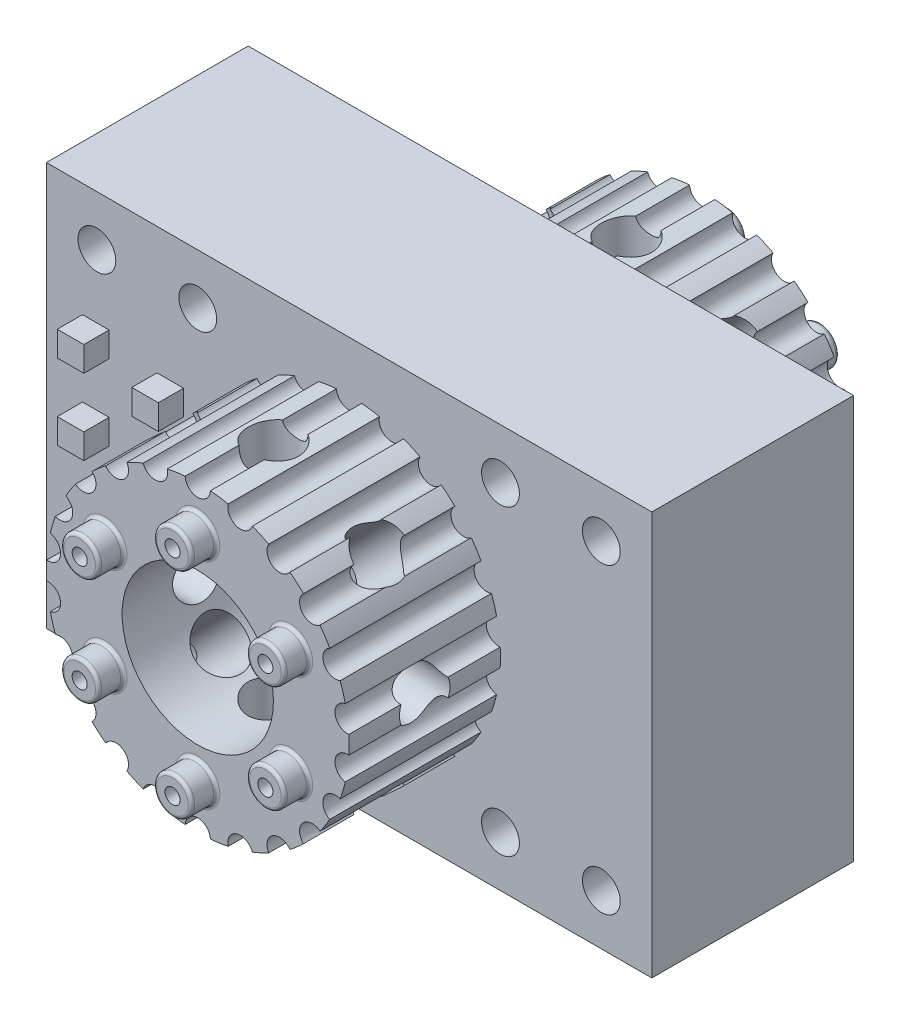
SolidWorks part; units mm, degrees
ref_plane "Front Plane" through (0, 0, 0) normal (0, 0, 1) x (1, 0, 0)
ref_plane "Top Plane" through (0, 0, 0) normal (0, 1, 0) x (1, 0, 0)
ref_plane "Right Plane" through (0, 0, 0) normal (1, 0, 0) x (0, 0, -1)
sketch "Sketch1" plane through (0, 0, 0) normal (0, 0, 1) x (1, 0, 0)
  line L1 (-76.2, -50.8) -> (76.2, -50.8)
  line L2 (-76.2, -50.8) -> (-76.2, 50.8)
  line L3 (-76.2, 50.8) -> (76.2, 50.8)
  line L4 (76.2, -50.8) -> (76.2, 50.8)
  line L5 (-76.2, -50.8) -> (76.2, 50.8) construction
  line L6 (-76.2, 50.8) -> (76.2, -50.8) construction
  point P0 (0, 0)
  dimension "D1" = 101.6
  dimension "D2" = 152.4
extrude "Boss-Extrude1" add sketch "Sketch1" along normal blind 25.4
sketch "Sketch2" plane through (0, 0, 25.4) normal (0, 0, 1) x (1, 0, 0)
  circle A0 centre (0, 0) radius 38.1
  dimension "D1" = 76.2
extrude "Extrude-Thin1" add sketch "Sketch2" along normal blind 38.1 thin
sketch "Sketch3" plane through (0, 0, 25.4) normal (0, 0, 1) x (1, 0, 0)
  line L0 (-76.2, 50.8) -> (-76.2, -50.8) construction
  line L1 (76.2, 50.8) -> (-76.2, 50.8) construction
  line L2 (-63.5, 38.1) -> (-38.1, 38.1) construction
  line L3 (-63.5, 38.1) -> (-63.5, -38.1) construction
  circle A0 centre (-63.5, 38.1) radius 4.7625
  circle A1 centre (-38.1, 38.1) radius 4.7625
  circle A2 centre (-12.7, 38.1) radius 4.7625
  circle A3 centre (12.7, 38.1) radius 4.7625
  circle A4 centre (38.1, 38.1) radius 4.7625
  circle A5 centre (63.5, 38.1) radius 4.7625
  circle A6 centre (-38.1, -38.1) radius 4.7625
  circle A7 centre (-12.7, -38.1) radius 4.7625
  circle A8 centre (12.7, -38.1) radius 4.7625
  circle A9 centre (38.1, -38.1) radius 4.7625
  circle A10 centre (63.5, -38.1) radius 4.7625
  circle A11 centre (-63.5, -38.1) radius 4.7625
  point P6 (63.4803, 38.0737)
  point P7 (63.2484, 37.7654)
  point P8 (0, 0)
  point P34 (63.5, -38.8955)
  dimension "D1" = 9.525
  dimension "D2" = 12.7
  dimension "D3" = 12.7
  dimension "D6" = 90
  dimension "D7" = 25.4
  dimension "D8" = 76.2
  dimension "D4" = 6
  dimension "D5" = 2
extrude "Cut-Extrude1" cut sketch "Sketch3" against normal through all
sketch "Sketch4" plane through (0, 0, 63.5) normal (0, 0, 1) x (1, 0, 0)
  arc A0 (-3.1722, 37.9677) -> (3.1722, 37.9677) centre (0, 38.1) ccw
  circle A1 centre (0, 0) radius 38.1 construction
  arc A2 (3.1722, 37.9677) -> (-3.1722, 37.9677) centre (0, 0) ccw
  arc A3 (13.7405, 35.536) -> (7.653, 37.3235) centre (0, 0) ccw
  arc A4 (7.653, 37.3235) -> (13.7405, 35.536) centre (10.734, 36.5567) ccw
  arc A5 (23.1956, 30.2254) -> (17.8582, 33.6555) centre (0, 0) ccw
  arc A6 (17.8582, 33.6555) -> (23.1956, 30.2254) centre (20.5984, 32.0518) ccw
  arc A7 (30.7715, 22.4661) -> (26.6167, 27.261) centre (0, 0) ccw
  arc A8 (26.6167, 27.261) -> (30.7715, 22.4661) centre (28.7941, 24.9502) ccw
  arc A9 (35.8544, 12.8868) -> (33.2188, 18.6579) centre (0, 0) ccw
  arc A10 (33.2188, 18.6579) -> (35.8544, 12.8868) centre (34.657, 15.8273) ccw
  arc A11 (38.0327, 2.2634) -> (37.1298, 8.5433) centre (0, 0) ccw
  arc A12 (37.1298, 8.5433) -> (38.0327, 2.2634) centre (37.7122, 5.4222) ccw
  arc A13 (37.1298, -8.5433) -> (38.0327, -2.2634) centre (0, 0) ccw
  arc A14 (38.0327, -2.2634) -> (37.1298, -8.5433) centre (37.7122, -5.4222) ccw
  arc A15 (33.2188, -18.6579) -> (35.8544, -12.8868) centre (0, 0) ccw
  arc A16 (35.8544, -12.8868) -> (33.2188, -18.6579) centre (34.657, -15.8273) ccw
  arc A17 (26.6167, -27.261) -> (30.7715, -22.4661) centre (0, 0) ccw
  arc A18 (30.7715, -22.4661) -> (26.6167, -27.261) centre (28.7941, -24.9502) ccw
  arc A19 (17.8582, -33.6555) -> (23.1956, -30.2254) centre (0, 0) ccw
  arc A20 (23.1956, -30.2254) -> (17.8582, -33.6555) centre (20.5984, -32.0518) ccw
  arc A21 (7.653, -37.3235) -> (13.7405, -35.536) centre (0, 0) ccw
  arc A22 (13.7405, -35.536) -> (7.653, -37.3235) centre (10.734, -36.5567) ccw
  arc A23 (-3.1722, -37.9677) -> (3.1722, -37.9677) centre (0, 0) ccw
  arc A24 (3.1722, -37.9677) -> (-3.1722, -37.9677) centre (0, -38.1) ccw
  arc A25 (-13.7405, -35.536) -> (-7.653, -37.3235) centre (0, 0) ccw
  arc A26 (-7.653, -37.3235) -> (-13.7405, -35.536) centre (-10.734, -36.5567) ccw
  arc A27 (-23.1956, -30.2254) -> (-17.8582, -33.6555) centre (0, 0) ccw
  arc A28 (-17.8582, -33.6555) -> (-23.1956, -30.2254) centre (-20.5984, -32.0518) ccw
  arc A29 (-30.7715, -22.4661) -> (-26.6167, -27.261) centre (0, 0) ccw
  arc A30 (-26.6167, -27.261) -> (-30.7715, -22.4661) centre (-28.7941, -24.9502) ccw
  arc A31 (-35.8544, -12.8868) -> (-33.2188, -18.6579) centre (0, 0) ccw
  arc A32 (-33.2188, -18.6579) -> (-35.8544, -12.8868) centre (-34.657, -15.8273) ccw
  arc A33 (-38.0327, -2.2634) -> (-37.1298, -8.5433) centre (0, 0) ccw
  arc A34 (-37.1298, -8.5433) -> (-38.0327, -2.2634) centre (-37.7122, -5.4222) ccw
  arc A35 (-37.1298, 8.5433) -> (-38.0327, 2.2634) centre (0, 0) ccw
  arc A36 (-38.0327, 2.2634) -> (-37.1298, 8.5433) centre (-37.7122, 5.4222) ccw
  arc A37 (-33.2188, 18.6579) -> (-35.8544, 12.8868) centre (0, 0) ccw
  arc A38 (-35.8544, 12.8868) -> (-33.2188, 18.6579) centre (-34.657, 15.8273) ccw
  arc A39 (-26.6167, 27.261) -> (-30.7715, 22.4661) centre (0, 0) ccw
  arc A40 (-30.7715, 22.4661) -> (-26.6167, 27.261) centre (-28.7941, 24.9502) ccw
  arc A41 (-17.8582, 33.6555) -> (-23.1956, 30.2254) centre (0, 0) ccw
  arc A42 (-23.1956, 30.2254) -> (-17.8582, 33.6555) centre (-20.5984, 32.0518) ccw
  arc A43 (-7.653, 37.3235) -> (-13.7405, 35.536) centre (0, 0) ccw
  arc A44 (-13.7405, 35.536) -> (-7.653, 37.3235) centre (-10.734, 36.5567) ccw
  point P72 (0, 0)
  dimension "D1" = 6.35
  dimension "D2" = 22
extrude "Cut-Extrude2" cut sketch "Sketch4" against normal up to surface (38.1 mm away)
sketch "Sketch5" plane through (0, 0, 63.5) normal (0, 0, 1) x (1, 0, 0)
  circle A0 centre (0, 26.9875) radius 4.7625
  point P2 (0, 0)
  dimension "D1" = 9.525
  dimension "D2" = 26.9875
extrude "Boss-Extrude2" add sketch "Sketch5" along normal blind 6.35
hole_wizard "#10-24 Tapped Hole1" positions "Sketch6" profile "Sketch7" tap size "#10-24" standard "ANSI Inch"
sketch "Sketch6" plane through (0, 0, 69.85) normal (0, 0, 1) x (1, 0, 0)
  point P0 (0, 26.9875)
sketch "Sketch7" plane through (0, 26.9875, 69.85) normal (1, 0, 0) x (0, -1, 0)
  line L0 (0, 0) -> (0, 13.9678)
  line L1 (0, 13.9678) -> (1.8986, 12.827)
  line L2 (1.8986, 12.827) -> (1.8986, 0)
  line L5 (1.8986, 0) -> (0, 0)
  line L10 (0, 13.9678) -> (-1.8987, 12.827) construction
  line L11 (0, -6.35) -> (0, 107.95) construction
  dimension "Tap Drill Dia." = 3.7973
  dimension "Tap Drill Depth" = 12.827
  dimension "Drill Angle" = 118
fillet "Fillet1" radius 0.7937 2 edges at (4.7625, 26.9875, 63.5) (4.7625, 26.9875, 69.85)
pattern_circular "CirPattern2" count 6 over 360 about axis through (0, 0, 0) along (0, 0, 1) of "Boss-Extrude2", "#10-24 Tapped Hole1", "Fillet1"
sketch "Sketch8" plane through (0, 0, 0) normal (0, 1, 0) x (1, 0, 0)
  circle A0 centre (0, -44.45) radius 6.35
  point P2 (0, 0)
  dimension "D1" = 12.7
  dimension "D2" = 44.45
extrude "Cut-Extrude3" cut sketch "Sketch8" against normal through all
pattern_circular "CirPattern3" count 8 over 360 about axis through (0, 0, 63.5) along (0, 0, 1) of "Cut-Extrude3"
sketch "Sketch9" plane through (0, 0, 25.4) normal (0, 0, 1) x (1, 0, 0)
  line L0 (-76.2, 50.8) -> (64.3124, 26.0239) construction
  line L1 (-67.1262, 22.1663) -> (-60.4345, 22.1663)
  line L2 (-67.1262, 22.1663) -> (-67.1262, 15.8928)
  line L3 (-67.1262, 15.8928) -> (-60.4345, 15.8928)
  line L4 (-60.4345, 22.1663) -> (-60.4345, 15.8928)
  line L5 (-67.1262, 22.1663) -> (-60.4345, 15.8928) construction
  line L6 (-67.1262, 15.8928) -> (-60.4345, 22.1663) construction
  line L7 (76.2, 50.8) -> (-76.2, 50.8) construction
  point P0 (-63.7803, 19.0295)
  dimension "D1" = 10
extrude "Boss-Extrude3" add sketch "Sketch9" along normal blind 6.35
pattern_linear "LPattern2" count 2 spacing 19.05 along (0.9848, -0.1736, 0) count 2 spacing 19.05 along (0, -1, 0) of "Boss-Extrude3"
mirror "Mirror1" of "LPattern2", "Boss-Extrude3", "CirPattern3", "Cut-Extrude3", "CirPattern2", "Fillet1", "#10-24 Tapped Hole1", "Boss-Extrude2", "Boss-Extrude1", "Extrude-Thin1", "Cut-Extrude1", "Cut-Extrude2"
